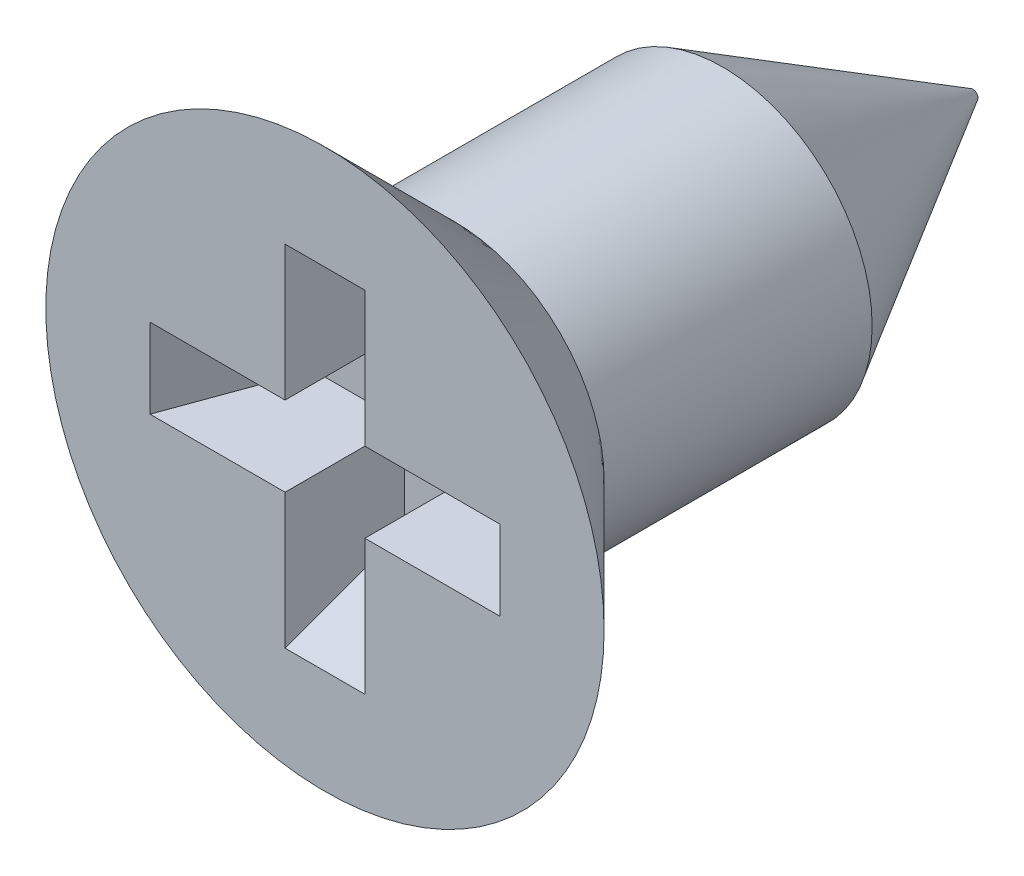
SolidWorks part; units mm, degrees
ref_plane "Plan de face" through (0, 0, 0) normal (0, 0, 1) x (1, 0, 0)
ref_plane "Plan de dessus" through (0, 0, 0) normal (0, 1, 0) x (1, 0, 0)
ref_plane "Plan de droite" through (0, 0, 0) normal (1, 0, 0) x (0, 0, -1)
sketch "Esquisse1" plane through (0, 0, 0) normal (1, 0, 0) x (0, 0, -1)
  line L0 (-1.6035, 0) -> (7.1529, 0) construction
  line L1 (0, 5.0438) -> (0, -4.594) construction
  line L2 (0, 2.8) -> (1.3, 1.5)
  line L3 (1.3, 1.5) -> (1.3, 0)
  line L4 (-1.442, 2.8) -> (2.7621, 2.8) construction
  line L5 (0, 2.8) -> (8.0274, -5.2274) construction
  line L6 (-1.0988, 1.5) -> (4.1029, 1.5) construction
  line L7 (1.3, 0) -> (0, 0)
  line L9 (0, 2.8) -> (0, 0)
  dimension "D1" = 45
revolve "Révolution2" add sketch "Esquisse1" angle 360 about L0
sketch "Esquisse3" plane through (0, 0, 0) normal (0, 0, 1) x (1, 0, 0)
  circle A0 centre (0, 0) radius 1.5
extrude "Extrusion1" add sketch "Esquisse3" against normal blind 6.5
sketch "Esquisse2" plane through (0, 0, 0) normal (0, 0, 1) x (1, 0, 0)
  line L0 (0.4, -0.4) -> (1.755, -0.4)
  line L1 (0.4, 0.4) -> (1.755, 0.4)
  line L2 (-1.755, -0.4) -> (-0.4, -0.4)
  line L3 (-0.4, 1.755) -> (-0.4, 0.4)
  line L4 (-1.755, 0.4) -> (-0.4, 0.4)
  line L5 (0.4, 1.755) -> (0.4, 0.4)
  line L6 (-0.4, 1.755) -> (0.4, 1.755)
  line L7 (1.755, 0.4) -> (1.755, -0.4)
  line L8 (0.4, -1.755) -> (-0.4, -1.755)
  line L9 (-1.755, -0.4) -> (-1.755, 0.4)
  line L10 (-0.4, -0.4) -> (-0.4, -1.755)
  line L12 (0.4, -0.4) -> (0.4, -1.755)
  circle A0 centre (0, 0) radius 1.8 construction
extrude "Enlèv. mat.-Extru.2" cut sketch "Esquisse2" against normal blind 1.2
draft "Dépouille3" type of draft neutral plane draft angle 20 faces to draft 4 parameters "D1"=20
chamfer "Chanfrein1" distance 1.45 angle 60 1 edges at (1.5, 0, -6.5)
